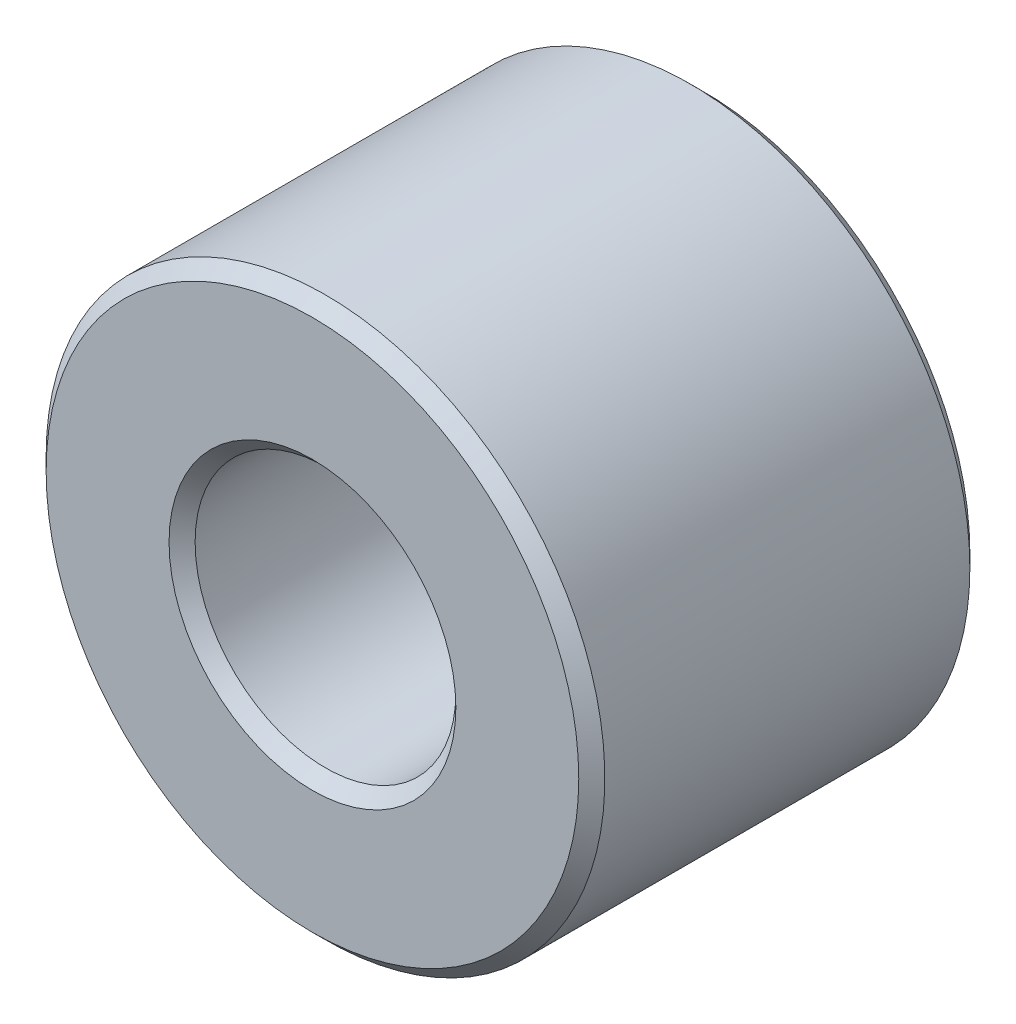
SolidWorks part; units mm, degrees
ref_plane "Front Plane" through (0, 0, 0) normal (0, 0, 1) x (1, 0, 0)
ref_plane "Top Plane" through (0, 0, 0) normal (0, 1, 0) x (1, 0, 0)
ref_plane "Right Plane" through (0, 0, 0) normal (1, 0, 0) x (0, 0, -1)
sketch "Sketch1" plane through (0, 0, 0) normal (0, 0, 1) x (1, 0, 0)
  circle A0 centre (0, 0) radius 7
  circle A1 centre (0, 0) radius 15
  dimension "D1" = 14
  dimension "D2" = 30
extrude "Boss-Extrude1" add sketch "Sketch1" along normal mid plane 21
chamfer "Chamfer1" distance 0.7 angle 45 4 edges at (7, 0, -10.5) (15, 0, -10.5) (7, 0, 10.5) (15, 0, 10.5)
